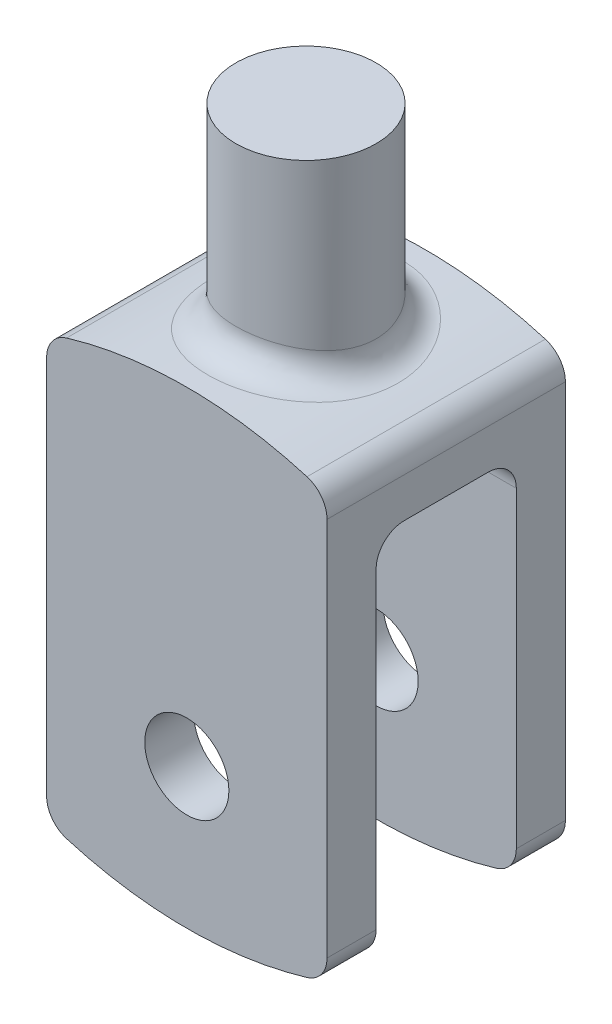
SolidWorks part; units mm, degrees
ref_plane "Front Plane" through (0, 0, 0) normal (0, 0, 1) x (1, 0, 0)
ref_plane "Top Plane" through (0, 0, 0) normal (0, 1, 0) x (1, 0, 0)
ref_plane "Right Plane" through (0, 0, 0) normal (1, 0, 0) x (0, 0, -1)
sketch "Sketch1" plane through (0, 0, 0) normal (0, 1, 0) x (1, 0, 0)
  circle A0 centre (0, 0) radius 6.35
  dimension "D1" = 12.7
extrude "Extrude1" add sketch "Sketch1" against normal blind 19.05
sketch "Sketch2" plane through (0, 0, 0) normal (0, 0, 1) x (1, 0, 0)
  line L0 (0, -19.05) -> (0, -38.1) construction
  line L1 (-6.35, -19.05) -> (6.35, -19.05) construction
  line L2 (-12.7, -19.05) -> (-12.7, -57.15)
  line L3 (-12.7, -57.15) -> (12.7, -57.15) construction
  line L4 (12.7, -57.15) -> (12.7, -19.05)
  line L5 (12.7, -38.1) -> (0, -38.1) construction
  arc A0 (-12.7, -19.05) -> (12.7, -19.05) centre (0, -54.971) cw
  arc A1 (-12.7, -57.15) -> (12.7, -57.15) centre (0, -21.229) ccw
  dimension "D2" = 38.1
  dimension "D1" = 25.4
  dimension "D3" = 38.1
extrude "Extrude2" add sketch "Sketch2" along normal mid plane 21.59
sketch "Sketch3" plane through (12.7, 0, 0) normal (1, 0, 0) x (0, 0, -1)
  line L0 (-10.795, -59.329) -> (10.795, -59.329) construction
  line L1 (-6.35, -24.491) -> (6.35, -24.491)
  line L2 (-6.35, -24.491) -> (-6.35, -59.329)
  line L3 (-6.35, -59.329) -> (6.35, -59.329)
  line L4 (6.35, -24.491) -> (6.35, -59.329)
  line L5 (0, -19.05) -> (0, -59.329) construction
  line L6 (-10.795, -19.05) -> (10.795, -19.05) construction
  line L7 (10.795, -16.871) -> (6.35, -16.871) construction
  dimension "D1" = 12.7
  dimension "D2" = 7.62
extrude "Cut-Extrude1" cut sketch "Sketch3" against normal through all
fillet "Fillet5" radius 2.54 9 edges at (-1.362, -16.8954, -6.2022) (0, -24.491, -6.35) (0, -24.491, 6.35) (12.7, -57.15, -8.5725) (12.7, -57.15, 8.5725) (-12.7, -57.15, 8.5725) (-12.7, -57.15, -8.5725) (12.7, -19.05, 0) (-12.7, -19.05, 0)
sketch "Sketch4" plane through (0, 0, 10.795) normal (0, 0, 1) x (1, 0, 0)
  line L0 (0, 0) -> (0, -46.629) construction
  circle A0 centre (0, -46.629) radius 3.81
  arc A1 (-10.8857, -57.7408) -> (10.8857, -57.7408) centre (0, -21.229) ccw construction
  dimension "D1" = 7.62
  dimension "D2" = 25.4
extrude "Cut-Extrude2" cut sketch "Sketch4" against normal through all
